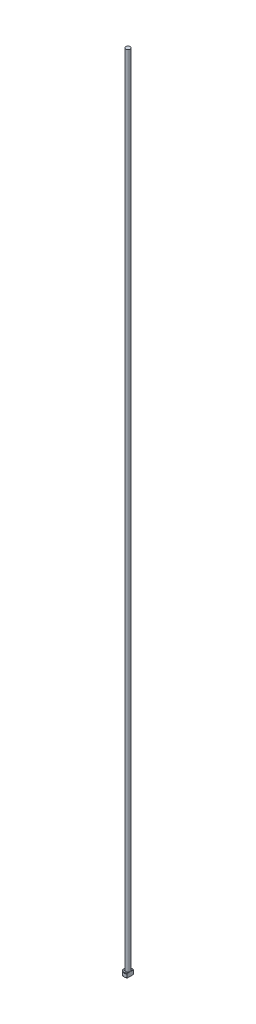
SolidWorks part; units mm, degrees
ref_plane "Front Plane" through (0, 0, 0) normal (0, 0, 1) x (1, 0, 0)
ref_plane "Top Plane" through (0, 0, 0) normal (0, 1, 0) x (1, 0, 0)
ref_plane "Right Plane" through (0, 0, 0) normal (1, 0, 0) x (0, 0, -1)
sketch "Sketch1" plane through (0, 0, 0) normal (0, 0, 1) x (1, 0, 0)
  line L0 (0, 259.9588) -> (0, -15.1925) construction
  line L1 (0, 0) -> (-2, 0)
  line L2 (-2, 0) -> (-2, 2)
  line L3 (-2, 2) -> (-1.1, 2)
  line L4 (-1.1, 2) -> (-1.1, 400)
  line L5 (-1.1, 400) -> (0, 400)
  line L6 (0, 400) -> (0, 0)
  dimension "L" = 400
  dimension "H" = 4
  dimension "T" = 2
  dimension "D" = 2.2
revolve "Revolve1" add sketch "Sketch1" angle 360 about L0
chamfer "Chamfer1" distance 0.2 angle 45 2 edges at (0, 2, 2) (0, 0, 2)
fillet "Fillet1" radius 0.2 1 edges at (0, 2, 1.1)
sketch "Sketch2" plane through (0, 0, 0) normal (0, 1, 0) x (1, 0, 0)
  line L0 (1.1, 1.6703) -> (1.1, -1.6703)
  circle A0 centre (0, 0) radius 2 construction
  arc A1 (1.1, -1.6703) -> (1.1, 1.6703) centre (0, 0) ccw
  circle A2 centre (0, 0) radius 1.1 construction
extrude "KEY" cut sketch "Sketch2" along normal through all
